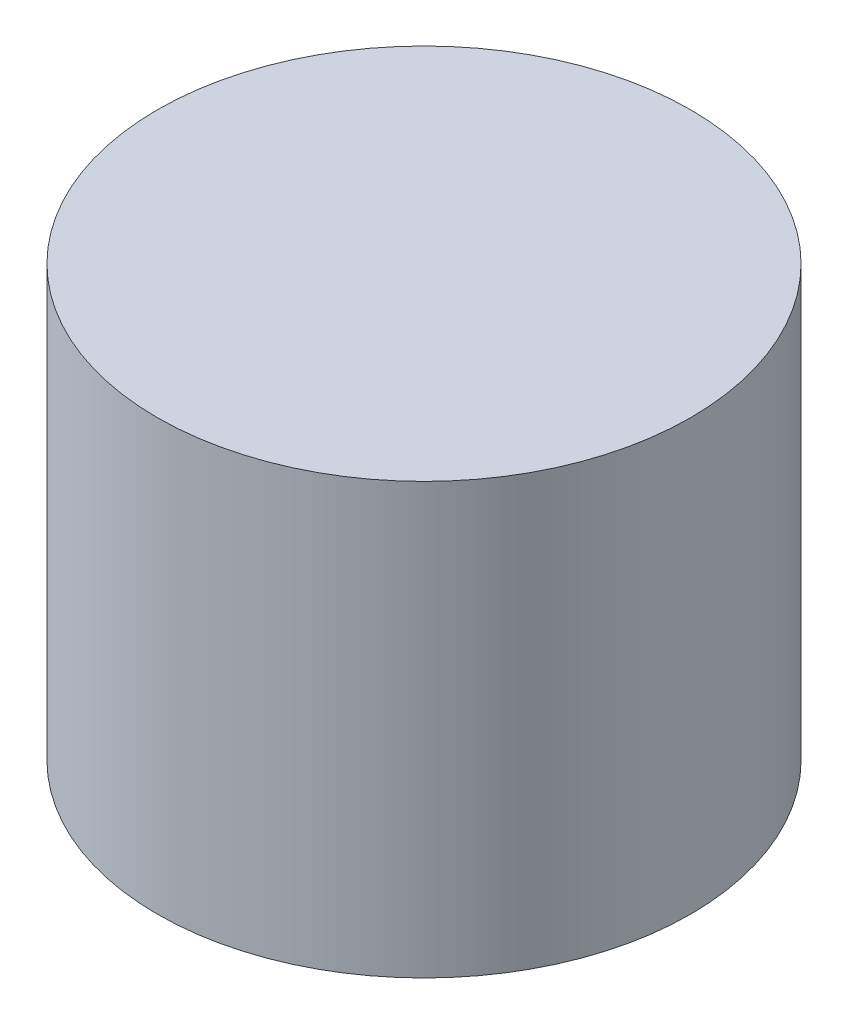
SolidWorks part; units mm, degrees
ref_plane "Front Plane" through (0, 0, 0) normal (0, 0, 1) x (1, 0, 0)
ref_plane "Top Plane" through (0, 0, 0) normal (0, 1, 0) x (1, 0, 0)
ref_plane "Right Plane" through (0, 0, 0) normal (1, 0, 0) x (0, 0, -1)
sketch "Sketch1" plane through (0, 0, 0) normal (0, 1, 0) x (1, 0, 0)
  circle A0 centre (0, 0) radius 31.496
extrude "Extrude1" add sketch "Sketch1" along normal blind 50.8
